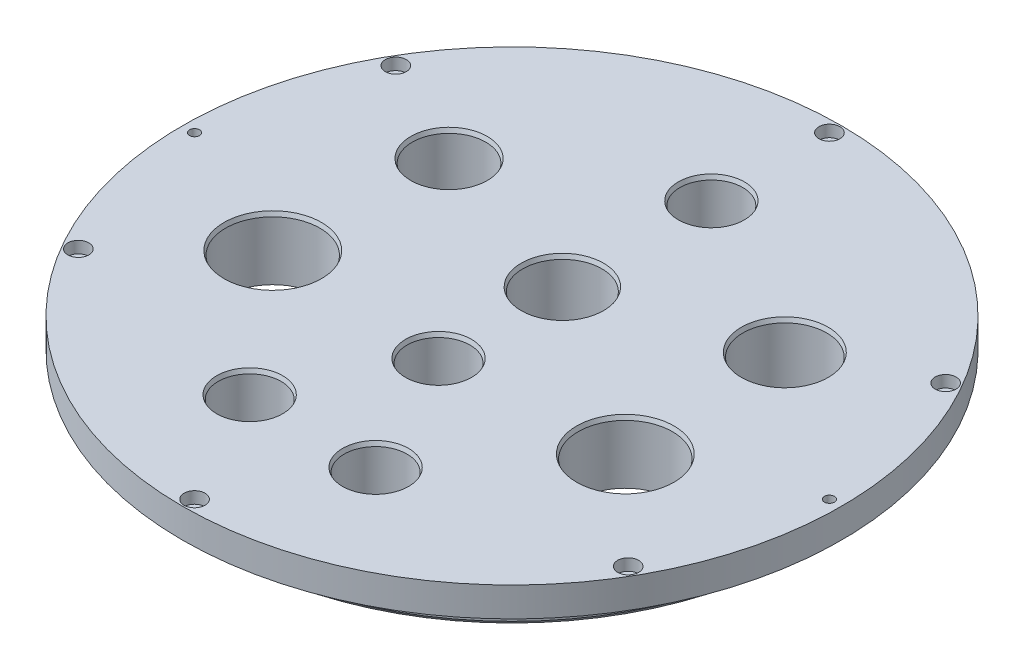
SolidWorks part; units mm, degrees
ref_plane "Front Plane" through (0, 0, 0) normal (0, 0, 1) x (1, 0, 0)
ref_plane "Top Plane" through (0, 0, 0) normal (0, 1, 0) x (1, 0, 0)
ref_plane "Right Plane" through (0, 0, 0) normal (1, 0, 0) x (0, 0, -1)
sketch "Sketch1" plane through (0, 0, 0) normal (0, 0, 1) x (1, 0, 0)
  line L0 (0, 0) -> (0, 19.05) construction
  line L1 (0, 0) -> (87.3125, 0)
  line L2 (87.3125, 0) -> (87.3125, 2.3622)
  line L3 (87.3125, 2.3622) -> (84.4931, 2.3622)
  line L4 (84.4931, 2.3622) -> (84.4931, 7.1628)
  line L5 (84.4931, 7.1628) -> (87.3125, 7.1628)
  line L6 (87.3125, 7.1628) -> (87.3125, 10.16)
  line L7 (87.3125, 10.16) -> (88.7349, 10.16)
  line L8 (99.7204, 10.16) -> (99.7204, 19.05)
  line L9 (99.7204, 19.05) -> (0, 19.05)
  line L10 (88.7349, 10.16) -> (88.7349, 12.1158)
  line L11 (88.7349, 12.1158) -> (92.2655, 12.1158)
  line L12 (92.2655, 12.1158) -> (92.2655, 10.16)
  line L13 (92.2655, 10.16) -> (99.7204, 10.16)
  line L14 (0, 0) -> (0, 19.05)
  dimension "D1" = 19.05
  dimension "D2" = 87.3125
  dimension "D3" = 99.7204
  dimension "D4" = 84.4931
  dimension "D5" = 4.8006
  dimension "D6" = 2.3622
  dimension "D7" = 3.5306
  dimension "D8" = 1.9558
  dimension "D9" = 88.7349
  dimension "D10" = 10.16
revolve "Revolve1" add sketch "Sketch1" angle 360 about L0
chamfer "Chamfer1" distance 0.762 angle 30 1 edges at (0, 0, -87.3125)
sketch "Sketch2" plane through (0, 19.05, 0) normal (0, 1, 0) x (1, 0, 0)
  circle A0 centre (0, 96.0501) radius 1.8415
  dimension "D1" = 3.683
  dimension "D2" = 96.0501
extrude "Cut-Extrude1" cut sketch "Sketch2" against normal through all
pattern_circular "CirPattern1" count 6 over 360 about axis through (0, 0, 0) along (0, 1, 0) of "Cut-Extrude1"
sketch "Sketch3" plane through (0, 19.05, 0) normal (0, 1, 0) x (1, 0, 0)
  circle A0 centre (0, 96.0501) radius 3.175
  circle A1 centre (-83.1818, 48.0251) radius 3.175
  circle A2 centre (-83.1818, -48.025) radius 3.175
  circle A3 centre (0, -96.0501) radius 3.175
  circle A4 centre (83.1818, -48.0251) radius 3.175
  circle A5 centre (83.1818, 48.025) radius 3.175
  dimension "D1" = 6.35
  dimension "D2" = 6.35
  dimension "D3" = 6.35
  dimension "D4" = 6.35
  dimension "D5" = 6.35
  dimension "D6" = 6.35
extrude "Cut-Extrude2" cut sketch "Sketch3" against normal blind 3.556
sketch "Sketch4" plane through (0, 19.05, 0) normal (0, 1, 0) x (1, 0, 0)
  circle A0 centre (96.0501, 0) radius 1.524
  circle A1 centre (-96.0501, 0) radius 1.524
  dimension "D1" = 3.048
  dimension "D2" = 3.048
  dimension "D3" = 96.0501
  dimension "D4" = 96.0501
extrude "Cut-Extrude3" cut sketch "Sketch4" against normal through all
sketch "Sketch5" plane through (0, 19.05, 0) normal (0, 1, 0) x (1, 0, 0)
  line L0 (0, 0) -> (0, 116.2578) construction
  line L1 (0, 0) -> (128.423, 0) construction
  circle A0 centre (-53.34, -19.05) radius 14.2875
  circle A1 centre (53.34, -19.05) radius 14.2875
  circle A2 centre (50.8, 31.75) radius 12.7
  circle A3 centre (-50.8, 31.75) radius 11.1125
  circle A4 centre (19.05, -60.325) radius 9.525
  circle A5 centre (-19.05, -60.325) radius 9.525
  circle A6 centre (0, 15.24) radius 12
  circle A7 centre (0, -22.225) radius 9.525
  circle A8 centre (0, 60.325) radius 9.525
  dimension "D1" = 28.575
  dimension "D2" = 25.4
  dimension "D3" = 22.225
  dimension "D4" = 19.05
  dimension "D5" = 24
  dimension "D6" = 38.1
  dimension "D7" = 60.325
  dimension "D8" = 19.05
  dimension "D9" = 53.34
  dimension "D10" = 15.24
  dimension "D11" = 50.8
  dimension "D12" = 31.75
  dimension "D13" = 38.1
  dimension "D14" = 60.325
extrude "connector holes" cut sketch "Sketch5" against normal through all
chamfer "Chamfer2" distance 1.27 angle 20 9 edges at (19.05, 19.05, 69.85) (-53.34, 19.05, 33.3375) (53.34, 19.05, 33.3375) (-19.05, 19.05, 69.85) (0, 19.05, -3.24) (-50.8, 19.05, -20.6375) (50.8, 19.05, -19.05) (0, 19.05, 31.75) (0, 19.05, -50.8)
sketch "Sketch6" plane through (0, 19.05, 0) normal (0, 1, 0) x (1, 0, 0)
  circle A0 centre (-53.34, -19.05) radius 19.05
  circle A1 centre (53.34, -19.05) radius 19.05
  circle A2 centre (-19.05, -60.325) radius 14.224
  circle A3 centre (-50.8, 31.75) radius 16.51
  circle A4 centre (50.8, 31.75) radius 16.637
  circle A5 centre (19.05, -60.325) radius 14.224
  circle A6 centre (0, -22.225) radius 14.224
  circle A7 centre (0, 60.325) radius 14.224
  dimension "D1" = 38.1
  dimension "D2" = 28.448
  dimension "D3" = 33.02
  dimension "D4" = 33.274
extrude "SPOT FACE" [suppressed] cut sketch "Sketch6" against normal blind 0.0254
hole_wizard "#6-40 Tapped Hole2" positions "Sketch12" profile "Sketch11" tap size "#6-40" standard "ANSI Inch"
sketch "Sketch12" plane through (0, 19.05, 0) normal (0, 1, 0) x (1, 0, 0)
  line L0 (19.05, -60.325) -> (19.05, -26.2689) construction
  line L1 (19.05, -60.325) -> (-26.0279, -60.325) construction
  point P0 (6.096, -47.371)
  point P2 (32.004, -47.371)
  point P4 (32.004, -73.279)
  point P6 (6.096, -73.279)
  dimension "D1" = 12.954
  dimension "D2" = 12.954
sketch "Sketch11" plane through (6.096, 19.05, 47.371) normal (1, 0, 0) x (0, 0, 1)
  line L0 (0, 0) -> (0, 9.7777)
  line L1 (0, 9.7777) -> (1.4351, 8.9154)
  line L2 (1.4351, 8.9154) -> (1.4351, 7.0104)
  line L3 (1.4351, 7.0104) -> (1.7526, 7.0104)
  line L4 (1.7526, 7.0104) -> (1.7526, 0)
  line L5 (1.7526, 0) -> (0, 0)
  line L10 (0, 9.7777) -> (-1.4351, 8.9154) construction
  line L11 (0, -6.35) -> (0, 107.95) construction
  dimension "Tap Drill Dia." = 2.8702
  dimension "Tap Drill Depth" = 8.9154
  dimension "Thread Major Dia." = 3.5052
  dimension "Thread Depth" = 7.0104
  dimension "Drill Angle" = 118
hole_wizard "#6-40 Tapped Hole1" positions "Sketch14" profile "Sketch13" tap size "#6-40" standard "ANSI Inch"
sketch "Sketch14" plane through (0, 19.05, 0) normal (0, 1, 0) x (1, 0, 0)
  line L0 (-19.05, -60.325) -> (-19.05, 64.0255) construction
  line L2 (-19.05, -60.325) -> (63.7845, -60.325) construction
  line L3 (0, -22.225) -> (0, -7.4827) construction
  line L4 (0, -22.225) -> (18.6505, -22.225) construction
  line L5 (0, 60.325) -> (0, 81.6372) construction
  line L6 (0, 60.325) -> (18.4527, 60.325) construction
  point P0 (-32.004, -47.371)
  point P2 (-6.096, -47.371)
  point P4 (-6.096, -73.279)
  point P6 (-32.004, -73.279)
  point P17 (-12.954, -9.271)
  point P19 (12.954, -9.271)
  point P28 (12.954, -35.179)
  point P29 (-12.954, -35.179)
  point P30 (-12.954, 73.279)
  point P32 (12.954, 73.279)
  point P41 (12.954, 47.371)
  point P42 (-12.954, 47.371)
  dimension "D1" = 12.954
  dimension "D2" = 12.954
  dimension "D3" = 12.954
  dimension "D4" = 12.954
  dimension "D5" = 12.954
  dimension "D6" = 12.954
sketch "Sketch13" plane through (-32.004, 19.05, 47.371) normal (1, 0, 0) x (0, 0, 1)
  line L0 (0, 0) -> (0, 9.7777)
  line L1 (0, 9.7777) -> (1.4351, 8.9154)
  line L2 (1.4351, 8.9154) -> (1.4351, 7.0104)
  line L3 (1.4351, 7.0104) -> (1.7526, 7.0104)
  line L4 (1.7526, 7.0104) -> (1.7526, 0)
  line L5 (1.7526, 0) -> (0, 0)
  line L10 (0, 9.7777) -> (-1.4351, 8.9154) construction
  line L11 (0, -6.35) -> (0, 107.95) construction
  dimension "Tap Drill Dia." = 2.8702
  dimension "Tap Drill Depth" = 8.9154
  dimension "Thread Major Dia." = 3.5052
  dimension "Thread Depth" = 7.0104
  dimension "Drill Angle" = 118
hole_wizard "M4x0.7 Tapped Hole1" positions "Sketch16" profile "Sketch15" tap size "M4x0.7" standard "ANSI Metric"
sketch "Sketch16" plane through (0, 19.05, 0) normal (0, 1, 0) x (1, 0, 0)
  line L9 (0, 15.24) -> (16.4689, 15.24) construction
  line L10 (0, 15.24) -> (0, 28.0128) construction
  point P0 (-12.7, 27.94)
  point P2 (12.7, 27.94)
  point P4 (12.7, 2.54)
  point P6 (-12.7, 2.54)
  dimension "D1" = 12.7
  dimension "D2" = 12.7
sketch "Sketch15" plane through (-12.7, 19.05, -27.94) normal (1, 0, 0) x (0, 0, 1)
  line L0 (0, 0) -> (0, 11.1006)
  line L1 (0, 11.1006) -> (1.65, 10.1092)
  line L2 (1.65, 10.1092) -> (1.65, 8.001)
  line L3 (1.65, 8.001) -> (2, 8.001)
  line L4 (2, 8.001) -> (2, 0)
  line L5 (2, 0) -> (0, 0)
  line L10 (0, 11.1006) -> (-1.65, 10.1092) construction
  line L11 (0, -6.35) -> (0, 107.95) construction
  dimension "Tap Drill Dia." = 3.3
  dimension "Tap Drill Depth" = 10.1092
  dimension "Thread Major Dia." = 4
  dimension "Thread Depth" = 8.001
  dimension "Drill Angle" = 118
hole_wizard "#8-32 Tapped Hole1" positions "Sketch18" profile "Sketch17" tap size "#8-32" standard "ANSI Inch"
sketch "Sketch18" plane through (0, 19.05, 0) normal (0, 1, 0) x (1, 0, 0)
  line L0 (53.34, -19.05) -> (80.4538, -19.05) construction
  line L1 (53.34, -19.05) -> (53.34, 1.9482) construction
  line L2 (0, 0) -> (0, -41.6073) construction
  point P0 (34.9758, -0.6858)
  point P2 (71.7042, -0.6858)
  point P4 (71.7042, -37.4142)
  point P6 (34.9758, -37.4142)
  point P20 (-71.7042, -37.4142)
  point P21 (-71.7042, -0.6858)
  point P22 (-34.9758, -0.6858)
  point P23 (-34.9758, -37.4142)
  dimension "D1" = 18.3642
  dimension "D2" = 18.3642
sketch "Sketch17" plane through (34.9758, 19.05, 0.6858) normal (1, 0, 0) x (0, 0, 1)
  line L0 (0, 0) -> (0, 11.7566)
  line L1 (0, 11.7566) -> (1.7272, 10.7188)
  line L2 (1.7272, 10.7188) -> (1.7272, 8.3312)
  line L3 (1.7272, 8.3312) -> (2.0828, 8.3312)
  line L4 (2.0828, 8.3312) -> (2.0828, 0)
  line L5 (2.0828, 0) -> (0, 0)
  line L10 (0, 11.7566) -> (-1.7272, 10.7188) construction
  line L11 (0, -6.35) -> (0, 107.95) construction
  dimension "Tap Drill Dia." = 3.4544
  dimension "Tap Drill Depth" = 10.7188
  dimension "Thread Major Dia." = 4.1656
  dimension "Thread Depth" = 8.3312
  dimension "Drill Angle" = 118
hole_wizard "#8-32 Tapped Hole2" positions "Sketch20" profile "Sketch19" tap size "#8-32" standard "ANSI Inch"
sketch "Sketch20" plane through (0, 19.05, 0) normal (0, 1, 0) x (1, 0, 0)
  line L0 (50.8, 31.75) -> (50.8, 54.5235) construction
  line L1 (50.8, 31.75) -> (80.2501, 31.75) construction
  point P0 (35.7378, 46.8122)
  point P2 (65.8622, 46.8122)
  point P4 (65.8622, 16.6878)
  point P6 (35.7378, 16.6878)
  dimension "D1" = 15.0622
  dimension "D2" = 15.0622
sketch "Sketch19" plane through (35.7378, 19.05, -46.8122) normal (1, 0, 0) x (0, 0, 1)
  line L0 (0, 0) -> (0, 11.7566)
  line L1 (0, 11.7566) -> (1.7272, 10.7188)
  line L2 (1.7272, 10.7188) -> (1.7272, 8.3312)
  line L3 (1.7272, 8.3312) -> (2.0828, 8.3312)
  line L4 (2.0828, 8.3312) -> (2.0828, 0)
  line L5 (2.0828, 0) -> (0, 0)
  line L10 (0, 11.7566) -> (-1.7272, 10.7188) construction
  line L11 (0, -6.35) -> (0, 107.95) construction
  dimension "Tap Drill Dia." = 3.4544
  dimension "Tap Drill Depth" = 10.7188
  dimension "Thread Major Dia." = 4.1656
  dimension "Thread Depth" = 8.3312
  dimension "Drill Angle" = 118
hole_wizard "#8-32 Tapped Hole3" positions "Sketch22" profile "Sketch21" tap size "#8-32" standard "ANSI Inch"
sketch "Sketch22" plane through (0, 0, 0) normal (0, -1, 0) x (-1, 0, 0)
  line L0 (0, 0) -> (0, 104.0888) construction
  line L1 (0, 0) -> (20.5109, 76.5477) construction
  point P0 (20.5109, 76.5477)
  point P14 (-20.5109, 76.5477)
  dimension "D1" = 79.248
  dimension "D2" = 15
sketch "Sketch21" plane through (-20.5109, 0, -76.5477) normal (1, 0, 0) x (0, 0, -1)
  line L0 (0, 0) -> (0, 11.7566)
  line L1 (0, 11.7566) -> (1.7272, 10.7188)
  line L2 (1.7272, 10.7188) -> (1.7272, 8.3312)
  line L3 (1.7272, 8.3312) -> (2.0828, 8.3312)
  line L4 (2.0828, 8.3312) -> (2.0828, 0)
  line L5 (2.0828, 0) -> (0, 0)
  line L10 (0, 11.7566) -> (-1.7272, 10.7188) construction
  line L11 (0, -6.35) -> (0, 107.95) construction
  dimension "Tap Drill Dia." = 3.4544
  dimension "Tap Drill Depth" = 10.7188
  dimension "Thread Major Dia." = 4.1656
  dimension "Thread Depth" = 8.3312
  dimension "Drill Angle" = 118
pattern_circular "CirPattern2" [suppressed] count 4 over 360
